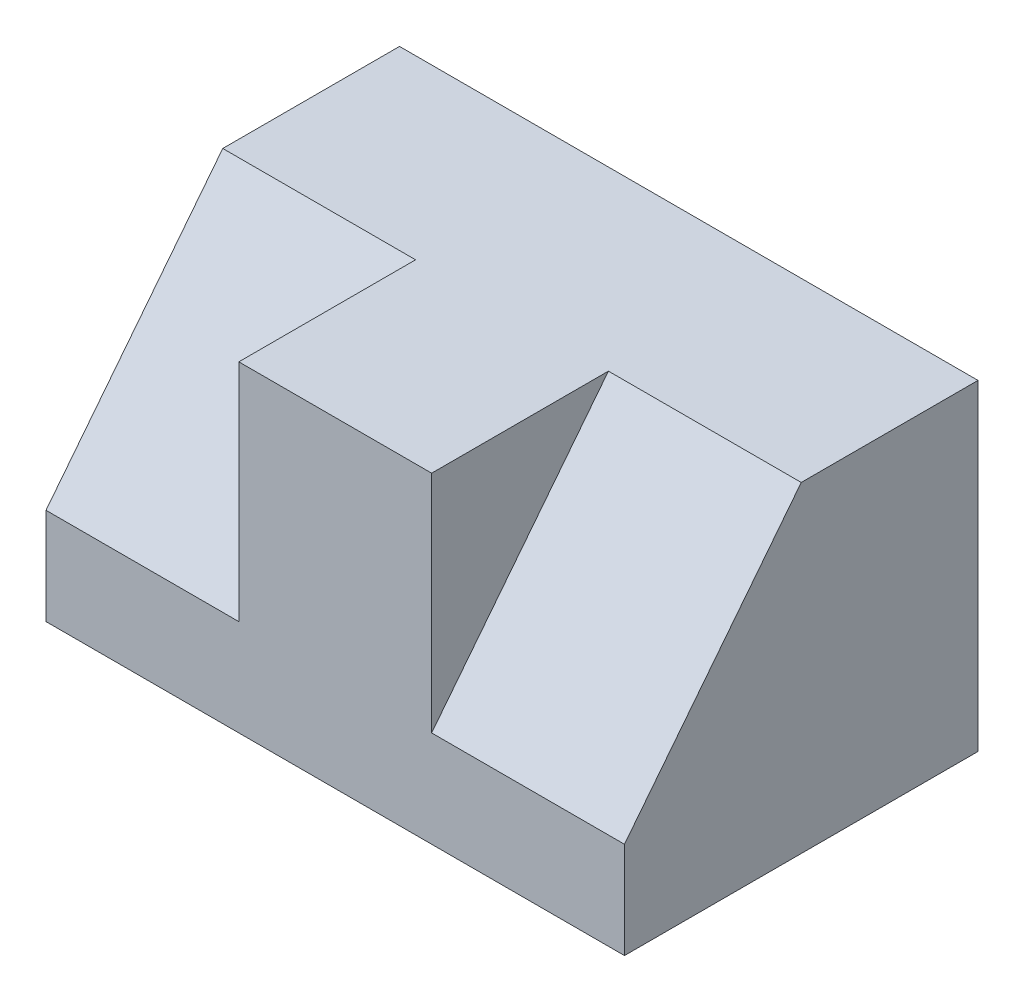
SolidWorks part; units mm, degrees
ref_plane "前视基准面" through (0, 0, 0) normal (0, 0, 1) x (1, 0, 0)
ref_plane "上视基准面" through (0, 0, 0) normal (0, 1, 0) x (1, 0, 0)
ref_plane "右视基准面" through (0, 0, 0) normal (1, 0, 0) x (0, 0, -1)
sketch "草图1" plane through (0, 0, 0) normal (0, 1, 0) x (1, 0, 0)
  line L1 (0, 0) -> (90, 0)
  line L2 (0, 0) -> (0, 55)
  line L3 (0, 55) -> (90, 55)
  line L4 (90, 0) -> (90, 55)
  dimension "D1" = 55
  dimension "D2" = 90
extrude "拉伸1" add sketch "草图1" along normal blind 50
sketch "草图2" plane through (90, 0, 0) normal (1, 0, 0) x (0, 0, -1)
  line L0 (0, 50) -> (27.5, 50)
  line L1 (0, 50) -> (55, 50) construction
  line L2 (0, 50) -> (0, 15)
  line L3 (0, 50) -> (0, 0) construction
  line L5 (0, 15) -> (27.5, 50)
  line L6 (0, 0) -> (55, 0) construction
  dimension "D1" = 15
extrude "切除-拉伸1" cut sketch "草图2" against normal blind 30
sketch "草图3" plane through (0, 0, 0) normal (-1, 0, 0) x (0, 0, 1)
  line L1 (-55, 50) -> (0, 50) construction
  line L2 (0, 15) -> (-27.5, 50) construction
  line L4 (-27.5, 50) -> (0, 50)
  line L5 (0, 15) -> (-27.5, 50)
  line L6 (0, 50) -> (0, 15)
extrude "切除-拉伸2" cut sketch "草图3" against normal blind 30
